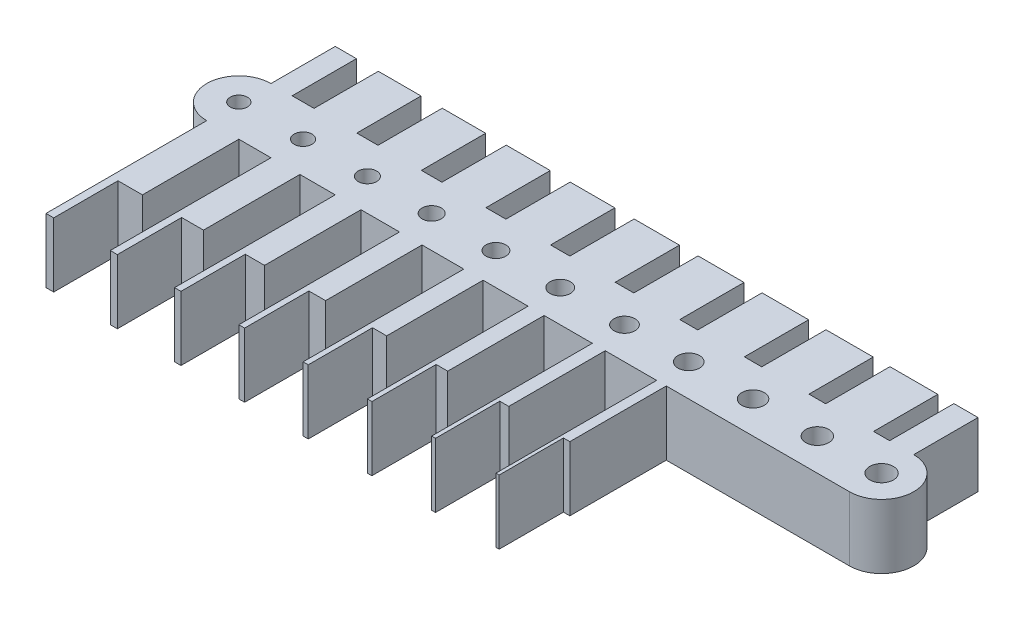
SolidWorks part; units mm, degrees
ref_plane "Front Plane" through (0, 0, 0) normal (0, 0, 1) x (1, 0, 0)
ref_plane "Top Plane" through (0, 0, 0) normal (0, 1, 0) x (1, 0, 0)
ref_plane "Right Plane" through (0, 0, 0) normal (1, 0, 0) x (0, 0, -1)
sketch "Sketch1" plane through (0, 0, 0) normal (0, 1, 0) x (1, 0, 0)
  line L0 (50, 10) -> (50, 0) construction
  line L1 (0, 0) -> (100, 0)
  line L3 (0, 10) -> (100, 10)
  line L5 (50, 5) -> (100, 5) construction
  line L6 (60, 10) -> (60, 0) construction
  line L7 (70, 10) -> (70, 0) construction
  line L8 (80, 10) -> (80, 0) construction
  line L9 (90, 10) -> (90, 0) construction
  line L10 (40, 10) -> (40, 0) construction
  line L11 (30, 10) -> (30, 0) construction
  line L12 (20, 10) -> (20, 0) construction
  line L13 (10, 10) -> (10, 0) construction
  circle A0 centre (50, 5) radius 1.5875
  circle A1 centre (60, 5) radius 1.6375
  circle A2 centre (70, 5) radius 1.6875
  circle A3 centre (80, 5) radius 1.7375
  circle A4 centre (90, 5) radius 1.7875
  circle A5 centre (40, 5) radius 1.5375
  circle A6 centre (30, 5) radius 1.4875
  circle A7 centre (20, 5) radius 1.4375
  circle A8 centre (10, 5) radius 1.3875
  arc A9 (100, 10) -> (100, 0) centre (100, 5) cw
  circle A10 centre (100, 5) radius 1.8375
  arc A11 (0, 10) -> (0, 0) centre (0, 5) ccw
  circle A12 centre (0, 5) radius 1.3375
  dimension "D3" = 5
  dimension "pin diameter" = 3.175
  dimension "D5" = 3.275
  dimension "D6" = 3.375
  dimension "D7" = 3.475
  dimension "D8" = 3.575
  dimension "D9" = 3.675
  dimension "D10" = 3.075
  dimension "D11" = 2.975
  dimension "D12" = 2.875
  dimension "D13" = 2.775
  dimension "D14" = 2.675
  dimension "D1" = 10
  dimension "D2" = 50
  dimension "D4" = 5
extrude "Pin" add sketch "Sketch1" along normal blind 10
sketch "Sketch2" plane through (0, 10, 0) normal (0, 1, 0) x (1, 0, 0)
  line L0 (0, 10) -> (0, 0) construction
  line L1 (0, 0) -> (5, 0)
  line L2 (0, 0) -> (0, -15)
  line L3 (0, -15) -> (5, -15)
  line L4 (5, 0) -> (5, -15)
  line L5 (10, 5) -> (10, 0) construction
  line L6 (0, 0) -> (100, 0) construction
  line L7 (20, 5) -> (20, 0) construction
  line L8 (30, 5) -> (30, 0) construction
  line L9 (40, 5) -> (40, 0) construction
  line L10 (50, 5) -> (50, 0) construction
  line L11 (60, 5) -> (60, 0) construction
  line L12 (70, 5) -> (70, 0) construction
  line L13 (80, 5) -> (80, 0) construction
  line L14 (90, 5) -> (90, 0) construction
  line L15 (100, 5) -> (100, 0) construction
  line L16 (50, 5) -> (50, 10) construction
  line L17 (20, 0) -> (24, 0)
  line L18 (20, 0) -> (20, -15)
  line L19 (20, -15) -> (24, -15)
  line L20 (24, 0) -> (24, -15)
  line L21 (40, 0) -> (43, 0)
  line L22 (40, 0) -> (40, -15)
  line L23 (40, -15) -> (43, -15)
  line L24 (43, 0) -> (43, -15)
  line L25 (60, 0) -> (62, 0)
  line L26 (60, 0) -> (60, -15)
  line L27 (60, -15) -> (62, -15)
  line L28 (62, 0) -> (62, -15)
  line L33 (100, 10) -> (0, 10) construction
  line L35 (10, 0) -> (14.5, 0)
  line L36 (10, 0) -> (10, -15)
  line L37 (10, -15) -> (14.5, -15)
  line L38 (14.5, 0) -> (14.5, -15)
  line L39 (30, 0) -> (33.5, 0)
  line L40 (30, 0) -> (30, -15)
  line L41 (30, -15) -> (33.5, -15)
  line L42 (33.5, 0) -> (33.5, -15)
  line L43 (50, 0) -> (52.5, 0)
  line L44 (50, 0) -> (50, -15)
  line L45 (50, -15) -> (52.5, -15)
  line L46 (52.5, 0) -> (52.5, -15)
  line L47 (70, 0) -> (71.5, 0)
  line L48 (70, 0) -> (70, -15)
  line L49 (70, -15) -> (71.5, -15)
  line L50 (71.5, 0) -> (71.5, -15)
  dimension "D1" = 15
  dimension "D2" = 5
  dimension "D3" = 4
  dimension "D4" = 3
  dimension "D5" = 2
  dimension "D7" = 4.5
  dimension "D8" = 3.5
  dimension "D9" = 2.5
  dimension "D10" = 1.5
extrude "Width Keep" add sketch "Sketch2" against normal up to surface (10 mm away)
sketch "Sketch3" plane through (0, 10, 0) normal (0, 1, 0) x (1, 0, 0)
  line L1 (0, -15) -> (1.2, -15)
  line L3 (0, -15) -> (0, -25)
  line L4 (0, -25) -> (1.2, -25)
  line L5 (1.2, -15) -> (1.2, -25)
  line L6 (10, -15) -> (11.1, -15)
  line L7 (10, -15) -> (10, -25)
  line L8 (10, -25) -> (11.1, -25)
  line L9 (11.1, -15) -> (11.1, -25)
  line L10 (20, -15) -> (21, -15)
  line L11 (20, -15) -> (20, -25)
  line L12 (20, -25) -> (21, -25)
  line L13 (21, -15) -> (21, -25)
  line L14 (30, -15) -> (30.9, -15)
  line L15 (30, -15) -> (30, -25)
  line L16 (30, -25) -> (30.9, -25)
  line L17 (30.9, -15) -> (30.9, -25)
  line L18 (40, -15) -> (40.8, -15)
  line L19 (40, -15) -> (40, -25)
  line L20 (40, -25) -> (40.8, -25)
  line L21 (40.8, -15) -> (40.8, -25)
  line L22 (50, -15) -> (50.7, -15)
  line L23 (50, -15) -> (50, -25)
  line L24 (50, -25) -> (50.7, -25)
  line L25 (50.7, -15) -> (50.7, -25)
  line L26 (60, -15) -> (60.6, -15)
  line L27 (60, -15) -> (60, -25)
  line L28 (60, -25) -> (60.6, -25)
  line L29 (60.6, -15) -> (60.6, -25)
  line L30 (70, -15) -> (70.5, -15)
  line L31 (70, -15) -> (70, -25)
  line L32 (70, -25) -> (70.5, -25)
  line L33 (70.5, -15) -> (70.5, -25)
  dimension "D1" = 10
  dimension "D2" = 1.2
  dimension "D3" = 1.1
  dimension "D4" = 1
  dimension "D5" = 0.9
  dimension "D6" = 0.8
  dimension "D7" = 0.7
  dimension "D8" = 0.6
  dimension "D9" = 0.5
extrude "Width Destroy" add sketch "Sketch3" against normal up to surface (10 mm away)
sketch "Sketch4" plane through (0, 10, 0) normal (0, 1, 0) x (1, 0, 0)
  line L0 (90, 5) -> (90, 10) construction
  line L1 (100, 10) -> (0, 10) construction
  line L2 (90, 5) -> (80, 5) construction
  line L3 (80, 5) -> (70, 5) construction
  line L4 (70, 5) -> (60, 5) construction
  line L5 (60, 5) -> (50, 5) construction
  line L6 (50, 5) -> (40, 5) construction
  line L7 (40, 5) -> (30, 5) construction
  line L8 (30, 5) -> (20, 5) construction
  line L9 (20, 5) -> (10, 5) construction
  line L10 (10, 5) -> (10, 10) construction
  line L11 (80, 5) -> (80, 10) construction
  line L12 (70, 5) -> (70, 10) construction
  line L13 (60, 5) -> (60, 10) construction
  line L14 (50, 5) -> (50, 10) construction
  line L15 (40, 5) -> (40, 10) construction
  line L16 (30, 5) -> (30, 10) construction
  line L17 (20, 5) -> (20, 10) construction
  line L18 (90, 5) -> (100, 5) construction
  line L19 (100, 5) -> (100, 10) construction
  line L20 (10, 5) -> (0, 5) construction
  line L21 (0, 5) -> (0, 10) construction
  line L22 (95, 5) -> (95, 10) construction
  line L23 (100, 10) -> (96.25, 10)
  line L24 (100, 10) -> (100, 20)
  line L25 (100, 20) -> (96.25, 20)
  line L26 (96.25, 10) -> (96.25, 20)
  line L27 (0, 10) -> (3.3, 10)
  line L28 (0, 10) -> (0, 20)
  line L29 (0, 20) -> (3.3, 20)
  line L30 (3.3, 10) -> (3.3, 20)
  line L31 (93.75, 10) -> (86.3, 10)
  line L32 (93.75, 10) -> (93.75, 20)
  line L33 (93.75, 20) -> (86.3, 20)
  line L34 (86.3, 10) -> (86.3, 20)
  line L35 (83.7, 10) -> (76.35, 10)
  line L36 (83.7, 10) -> (83.7, 20)
  line L37 (83.7, 20) -> (76.35, 20)
  line L38 (76.35, 10) -> (76.35, 20)
  line L39 (73.65, 10) -> (66.4, 10)
  line L40 (73.65, 10) -> (73.65, 20)
  line L41 (73.65, 20) -> (66.4, 20)
  line L42 (66.4, 10) -> (66.4, 20)
  line L43 (63.6, 10) -> (56.45, 10)
  line L44 (63.6, 10) -> (63.6, 20)
  line L45 (63.6, 20) -> (56.45, 20)
  line L46 (56.45, 10) -> (56.45, 20)
  line L47 (53.55, 10) -> (46.5, 10)
  line L48 (53.55, 10) -> (53.55, 20)
  line L49 (53.55, 20) -> (46.5, 20)
  line L50 (46.5, 10) -> (46.5, 20)
  line L51 (43.5, 10) -> (36.55, 10)
  line L52 (43.5, 10) -> (43.5, 20)
  line L53 (43.5, 20) -> (36.55, 20)
  line L54 (36.55, 10) -> (36.55, 20)
  line L55 (33.45, 10) -> (26.6, 10)
  line L56 (33.45, 10) -> (33.45, 20)
  line L57 (33.45, 20) -> (26.6, 20)
  line L58 (26.6, 10) -> (26.6, 20)
  line L59 (23.4, 10) -> (16.65, 10)
  line L60 (23.4, 10) -> (23.4, 20)
  line L61 (23.4, 20) -> (16.65, 20)
  line L62 (16.65, 10) -> (16.65, 20)
  line L63 (13.35, 10) -> (6.7, 10)
  line L64 (13.35, 10) -> (13.35, 20)
  line L65 (13.35, 20) -> (6.7, 20)
  line L66 (6.7, 10) -> (6.7, 20)
  line L67 (85, 5) -> (85, 10) construction
  line L68 (75, 5) -> (75, 10) construction
  line L69 (65, 5) -> (65, 10) construction
  line L70 (55, 5) -> (55, 10) construction
  line L71 (45, 5) -> (45, 10) construction
  line L72 (35, 5) -> (35, 10) construction
  line L73 (25, 5) -> (25, 10) construction
  line L74 (15, 5) -> (15, 10) construction
  line L75 (5, 5) -> (5, 10) construction
  dimension "D1" = 10
  dimension "D2" = 2.5
  dimension "D3" = 2.6
  dimension "D4" = 2.7
  dimension "D5" = 2.8
  dimension "D6" = 2.9
  dimension "D7" = 3
  dimension "D8" = 3.1
  dimension "D9" = 3.2
  dimension "D10" = 3.3
  dimension "D11" = 3.4
extrude "Pulley Thickness" add sketch "Sketch4" against normal up to surface (10 mm away)
ref_point "Ref Point"
equation "\"D5@Sketch1\"=\"pin diameter@Sketch1\"+0.1"
equation "\"D6@Sketch1\"=\"pin diameter@Sketch1\"+0.2"
equation "\"D7@Sketch1\"=\"pin diameter@Sketch1\"+0.3"
equation "\"D8@Sketch1\"=\"pin diameter@Sketch1\"+0.4"
equation "\"D9@Sketch1\"=\"pin diameter@Sketch1\"+0.5"
equation "\"D10@Sketch1\"=\"pin diameter@Sketch1\"-0.1"
equation "\"D11@Sketch1\"=\"pin diameter@Sketch1\"-0.2"
equation "\"D12@Sketch1\"=\"pin diameter@Sketch1\"-0.3"
equation "\"D13@Sketch1\"=\"pin diameter@Sketch1\"-0.4"
equation "\"D14@Sketch1\"=\"pin diameter@Sketch1\"-0.5"
